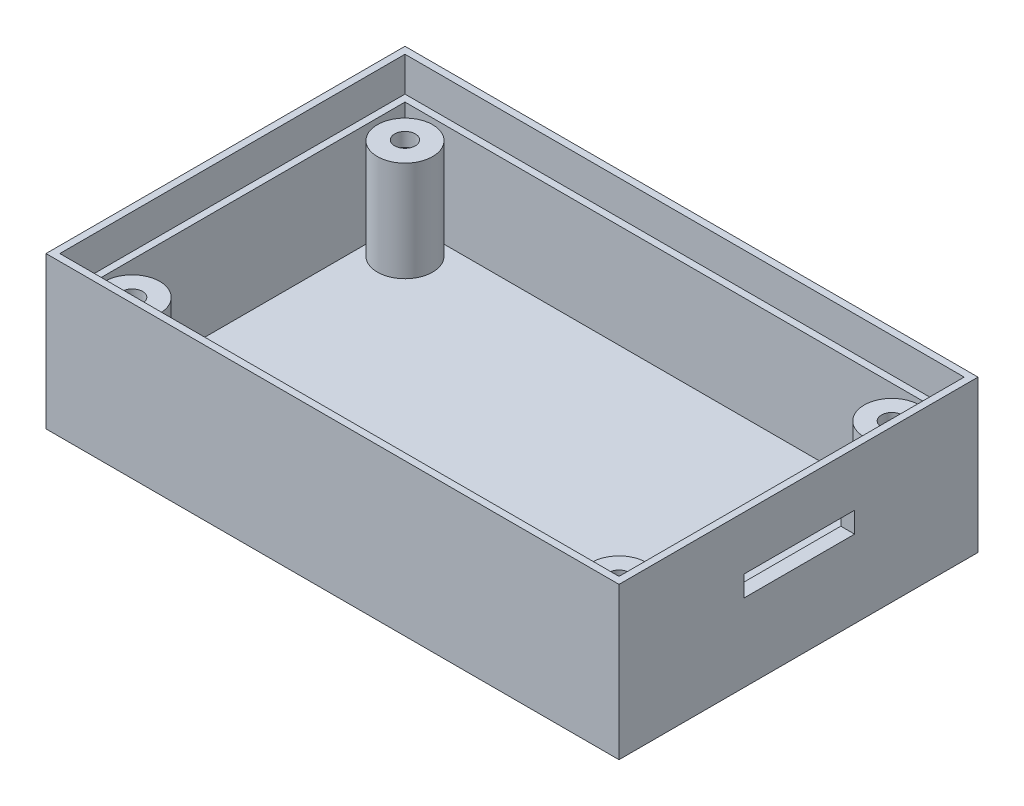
SolidWorks part; units mm, degrees
ref_plane "Front Plane" through (0, 0, 0) normal (0, 0, 1) x (1, 0, 0)
ref_plane "Top Plane" through (0, 0, 0) normal (0, 1, 0) x (1, 0, 0)
ref_plane "Right Plane" through (0, 0, 0) normal (1, 0, 0) x (0, 0, -1)
sketch "Sketch2" plane through (0, 0, 0) normal (0, 1, 0) x (1, 0, 0)
  line L0 (-15.9414, -25.7613) -> (67.0586, -25.7613)
  line L1 (67.0586, -25.7613) -> (67.0586, 26.2387)
  line L2 (67.0586, 26.2387) -> (-15.9414, 26.2387)
  line L3 (-15.9414, 26.2387) -> (-15.9414, -25.7613)
extrude "Boss-Extrude1" add sketch "Sketch2" along normal blind 2
sketch "Sketch3" plane through (0, 2, 0) normal (0, 1, 0) x (1, 0, 0)
  line L0 (-15.9414, 26.2387) -> (-13.9414, 26.2387)
  line L1 (-15.9414, 26.2387) -> (67.0586, 26.2387)
  line L2 (-15.9414, 26.2387) -> (-15.9414, -25.7613)
  line L3 (-15.9414, -25.7613) -> (67.0586, -25.7613)
  line L4 (67.0586, 26.2387) -> (67.0586, -25.7613)
  line L6 (67.0586, -25.7613) -> (67.0586, -23.7613)
  line L9 (-13.9414, 24.2387) -> (65.0586, 24.2387)
  line L10 (-13.9414, 24.2387) -> (-13.9414, -23.7613)
  line L11 (-13.9414, -23.7613) -> (65.0586, -23.7613)
  line L12 (65.0586, 24.2387) -> (65.0586, -23.7613)
sketch "Sketch4" plane through (0, 2, 0) normal (0, 1, 0) x (1, 0, 0)
  line L1 (-15.9414, 26.2387) -> (67.0586, 26.2387)
  line L2 (-15.9414, 26.2387) -> (-15.9414, -25.7613)
  line L3 (-15.9414, -25.7613) -> (67.0586, -25.7613)
  line L4 (67.0586, 26.2387) -> (67.0586, -25.7613)
  line L5 (-13.9414, 24.2387) -> (65.0586, 24.2387)
  line L6 (-13.9414, 24.2387) -> (-13.9414, -23.7613)
  line L7 (-13.9414, -23.7613) -> (65.0586, -23.7613)
  line L8 (65.0586, 24.2387) -> (65.0586, -23.7613)
extrude "Boss-Extrude5" add sketch "Sketch4" along normal blind 20
sketch "Sketch5" plane through (0, 22, 0) normal (0, 1, 0) x (1, 0, 0)
  line L7 (-14.9414, 25.2387) -> (66.0586, 25.2387)
  line L8 (-14.9414, 25.2387) -> (-14.9414, -24.7613)
  line L9 (-14.9414, -24.7613) -> (66.0586, -24.7613)
  line L10 (66.0586, 25.2387) -> (66.0586, -24.7613)
extrude "Cut-Extrude1" cut sketch "Sketch5" against normal blind 5
sketch "Sketch10" plane through (0, 2, 0) normal (0, 1, 0) x (1, 0, 0)
  circle A0 centre (-9.6047, 19.9019) radius 4
extrude "Boss-Extrude31" add sketch "Sketch10" along normal blind 14.5 contours A0
sketch "Sketch11" plane through (0, 2, 0) normal (0, 1, 0) x (1, 0, 0)
  circle A0 centre (-9.6988, -19.5187) radius 4
  circle A1 centre (60.8159, -19.5187) radius 4
  circle A2 centre (60.8159, 19.996) radius 4
extrude "Boss-Extrude32" add sketch "Sketch11" along normal blind 14.5
sketch "Sketch12" plane through (0, 16.5, 0) normal (0, 1, 0) x (1, 0, 0)
  circle A0 centre (-9.6988, 19.996) radius 1.5
  circle A1 centre (-9.6988, -19.5187) radius 1.5
  circle A2 centre (60.8159, -19.5187) radius 1.5
  circle A3 centre (60.8159, 19.996) radius 1.5
extrude "Cut-Extrude3" cut sketch "Sketch12" against normal blind 20
sketch "Sketch13" plane through (0, 0, 0) normal (0, -1, 0) x (1, 0, 0)
  circle A0 centre (-9.6988, 19.5187) radius 2.5
  circle A1 centre (60.8159, 19.5187) radius 2.5
  circle A2 centre (60.8159, -19.996) radius 2.5
  circle A3 centre (-9.6988, -19.996) radius 2.5
extrude "Cut-Extrude4" cut sketch "Sketch13" against normal blind 14.5
sketch "Sketch14" plane through (67.0586, 0, 0) normal (1, 0, 0) x (0, 0, -1)
  line L2 (8.3632, 11.2356) -> (-7.6368, 11.2356)
  line L3 (8.3632, 11.2356) -> (8.3632, 14.2394)
  line L4 (8.3632, 14.2394) -> (-7.6368, 14.2394)
  line L5 (-7.6368, 14.2394) -> (-7.6368, 11.2356)
extrude "Cut-Extrude5" cut sketch "Sketch14" against normal blind 2
